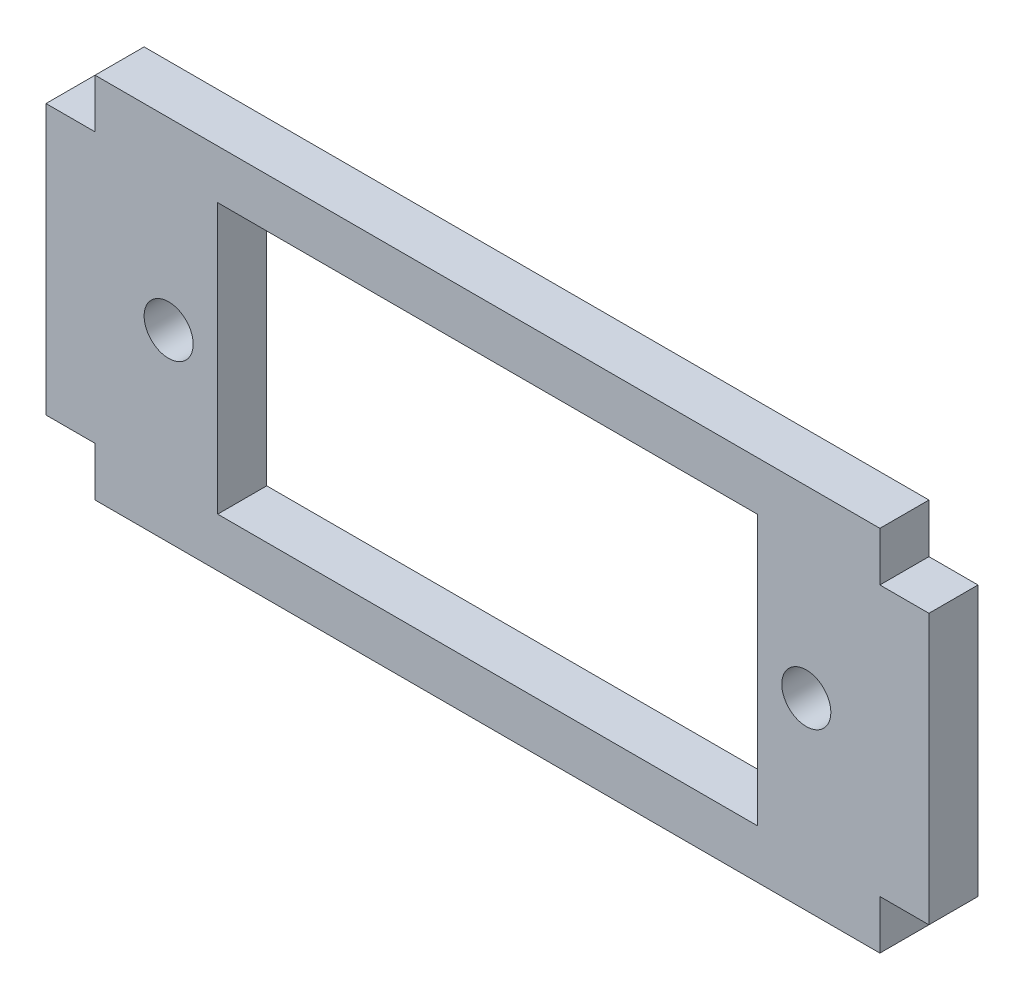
SolidWorks part; units mm, degrees
ref_plane "Front Plane" through (0, 0, 0) normal (0, 0, 1) x (1, 0, 0)
ref_plane "Top Plane" through (0, 0, 0) normal (0, 1, 0) x (1, 0, 0)
ref_plane "Right Plane" through (0, 0, 0) normal (1, 0, 0) x (0, 0, -1)
sketch "Sketch1" plane through (0, 0, 0) normal (0, 0, 1) x (1, 0, 0)
  line L0 (15, -0.5) -> (15, -5.5) construction
  line L1 (11, -5.5) -> (-11, -5.5)
  line L2 (11, -5.5) -> (11, 5.5)
  line L3 (11, 5.5) -> (-11, 5.5)
  line L4 (-11, -5.5) -> (-11, 5.5)
  line L5 (-18, 7.5) -> (18, 7.5)
  line L6 (-18, 7.5) -> (-18, -7.5)
  line L7 (-18, -7.5) -> (18, -7.5)
  line L8 (18, 7.5) -> (18, -7.5)
  line L9 (-18, 7.5) -> (18, -7.5) construction
  line L10 (-18, -7.5) -> (18, 7.5) construction
  point P6 (0, 0)
extrude "Boss-Extrude1" add sketch "Sketch1" along normal blind 2
other "Cavity9"
other "servoFitSide<3>@servoFitBottomASSEM3"
other "Cavity10"
other "servoFitSide<5>@servoFitBottomASSEM1"
sketch "Sketch4" plane through (0, 0, 2) normal (0, 0, 1) x (1, 0, 0)
  arc A0 (-13.866, -0.5) -> (-13.866, 0.5) centre (-13, 0) ccw construction
  arc A1 (13.866, 0.5) -> (13.866, -0.5) centre (13, 0) ccw construction
  arc A2 (-13.866, -0.5) -> (-13.866, 0.5) centre (-13, 0) ccw construction
  arc A3 (13.866, 0.5) -> (13.866, -0.5) centre (13, 0) ccw construction
  circle A4 centre (-13, 0) radius 1
  circle A5 centre (13, 0) radius 1
extrude "Cut-Extrude1" cut sketch "Sketch4" against normal blind 2
equation "\"anch\" = 2"
equation "\"alt\" = 100"
equation "\"pilanch\" = 100"
equation "\"pilalt\" = 250"
equation "\"bodyHeigh\" = 60"
equation "\"dorsalFinHeigh\" = 400"
equation "\"D2@Sketch1\"=\"anch\""
equation "\"D1@Boss-Extrude1\"=\"anch\""
equation "\"D1@Cut-Extrude1\"=\"anch\""
